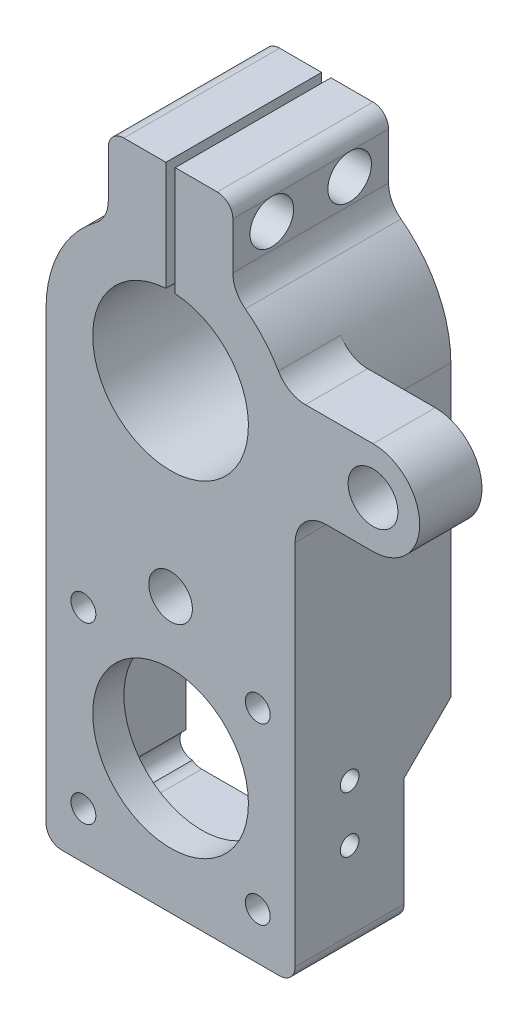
SolidWorks part; units mm, degrees
ref_plane "前视基准面" through (0, 0, 0) normal (0, 0, 1) x (1, 0, 0)
ref_plane "上视基准面" through (0, 0, 0) normal (0, 1, 0) x (1, 0, 0)
ref_plane "右视基准面" through (0, 0, 0) normal (1, 0, 0) x (0, 0, -1)
sketch "草图1" plane through (0, 0, 0) normal (0, 0, 1) x (1, 0, 0)
  line L0 (0, 0) -> (0, 105) construction
  line L1 (0, 0) -> (0, -43) construction
  line L2 (0, -43) -> (40, -43)
  line L3 (0, -43) -> (-40, -43)
  line L4 (0, 105) -> (65, 105) construction
  line L5 (65, 120) -> (43.3013, 120)
  line L6 (65, 90) -> (50, 90)
  line L7 (40, -43) -> (40, 80)
  line L8 (-40, -43) -> (-40, 105)
  line L9 (0, 105) -> (0, 165) construction
  line L10 (0, 165) -> (15, 165)
  line L11 (0, 165) -> (-15, 165)
  line L12 (-20, 160) -> (-20, 145)
  line L13 (20, 160) -> (20, 145)
  line L14 (0, 0) -> (28, 0) construction
  line L15 (28, 0) -> (28, 28) construction
  circle A0 centre (0, 0) radius 25
  circle A1 centre (0, 105) radius 25
  arc A2 (65, 90) -> (65, 120) centre (65, 105) ccw
  circle A3 centre (65, 105) radius 8
  arc A4 (34.641, 125) -> (24, 137) centre (0, 105) ccw
  arc A5 (34.641, 125) -> (43.3013, 120) centre (43.3013, 130) ccw
  arc A6 (50, 90) -> (40, 80) centre (50, 80) ccw
  arc A7 (-24, 137) -> (-40, 105) centre (0, 105) ccw
  arc A8 (20, 145) -> (24, 137) centre (30, 145) ccw
  arc A9 (-20, 145) -> (-24, 137) centre (-30, 145) cw
  arc A10 (15, 165) -> (20, 160) centre (15, 160) cw
  arc A11 (-20, 160) -> (-15, 165) centre (-15, 160) cw
  circle A12 centre (28, 28) radius 4
  circle A13 centre (28, -28) radius 4
  circle A14 centre (-28, -28) radius 4
  circle A15 centre (-28, 28) radius 4
  circle A16 centre (0, 45) radius 7
  dimension "D1" = 10
  dimension "D2" = 10
  dimension "D3" = 5
  dimension "D4" = 45
extrude "凸台-拉伸1" add sketch "草图1" along normal blind 20
fillet "圆角1" radius 5 2 edges at (-40, -43, 10) (40, -43, 10)
sketch "草图4" plane through (0, 0, 0) normal (0, 0, -1) x (-1, 0, 0)
  line L0 (-40, -38) -> (-40, 80) construction
  line L1 (35, -43) -> (-35, -43) construction
  line L2 (40, 105) -> (40, -38) construction
  line L3 (20, 160) -> (20, 145) construction
  line L4 (-15, 165) -> (15, 165) construction
  line L5 (-20, 145) -> (-20, 160) construction
  line L6 (-40, -38) -> (-40, 105)
  line L7 (35, -43) -> (-35, -43)
  line L8 (40, 105) -> (40, -38)
  line L9 (20, 160) -> (20, 145)
  line L10 (-15, 165) -> (15, 165)
  line L11 (-20, 145) -> (-20, 160)
  circle A0 centre (28, -28) radius 4 construction
  circle A1 centre (-28, -28) radius 4 construction
  circle A2 centre (28, 28) radius 4 construction
  circle A3 centre (-28, 28) radius 4 construction
  circle A4 centre (0, 45) radius 7 construction
  circle A5 centre (0, 0) radius 25 construction
  arc A6 (-40, -38) -> (-35, -43) centre (-35, -38) ccw construction
  arc A7 (35, -43) -> (40, -38) centre (35, -38) ccw construction
  arc A8 (20, 145) -> (24, 137) centre (30, 145) ccw construction
  arc A9 (20, 160) -> (15, 165) centre (15, 160) ccw construction
  arc A10 (-15, 165) -> (-20, 160) centre (-15, 160) ccw construction
  arc A11 (-24, 137) -> (-20, 145) centre (-30, 145) ccw construction
  circle A12 centre (0, 105) radius 25 construction
  circle A13 centre (28, -28) radius 4
  circle A14 centre (-28, -28) radius 4
  circle A15 centre (28, 28) radius 4
  circle A16 centre (-28, 28) radius 4
  circle A17 centre (0, 45) radius 7
  circle A18 centre (0, 0) radius 25
  arc A19 (-40, -38) -> (-35, -43) centre (-35, -38) ccw
  arc A20 (35, -43) -> (40, -38) centre (35, -38) ccw
  arc A21 (20, 145) -> (24, 137) centre (30, 145) ccw
  arc A22 (20, 160) -> (15, 165) centre (15, 160) ccw
  arc A23 (-15, 165) -> (-20, 160) centre (-15, 160) ccw
  arc A24 (-24, 137) -> (-20, 145) centre (-30, 145) ccw
  circle A25 centre (0, 105) radius 25
  arc A26 (40, 105) -> (24, 137) centre (0, 105) ccw
  arc A27 (-24, 137) -> (-40, 105) centre (0, 105) ccw
extrude "凸台-拉伸3" add sketch "草图4" along normal blind 30
sketch "草图5" plane through (0, 0, -30) normal (0, 0, -1) x (-1, 0, 0)
  line L0 (0, 0) -> (30, 0) construction
  line L1 (30, 59.1742) -> (30, -28)
  line L2 (25, -33) -> (-25, -33)
  line L3 (-30, -28) -> (-30, 59.1742)
  arc A0 (-16, 68.3394) -> (16, 68.3394) centre (0, 105) ccw
  arc A1 (30, -28) -> (25, -33) centre (25, -28) cw
  arc A2 (-30, -28) -> (-25, -33) centre (-25, -28) ccw
  arc A3 (16, 68.3394) -> (30, 59.1742) centre (20, 59.1742) cw
  arc A4 (-16, 68.3394) -> (-30, 59.1742) centre (-20, 59.1742) ccw
  dimension "D1" = 5
  dimension "D2" = 10
extrude "切除-拉伸1" cut sketch "草图5" against normal blind 40
sketch "草图6" plane through (40, 0, 0) normal (1, 0, 0) x (0, 0, -1)
  line L0 (30, -43) -> (-20, -43) construction
  line L1 (30, -43) -> (15, -43)
  line L2 (30, -43) -> (30, -3) construction
  line L3 (30, -3) -> (15, -3) construction
  line L4 (15, -3) -> (15, -43)
  line L5 (15, -3) -> (30, 12)
  line L6 (30, 105) -> (30, -38) construction
  line L7 (30, 12) -> (30, -43)
extrude "切除-拉伸2" cut sketch "草图6" against normal blind 80
sketch "草图7" plane through (0, 165, 0) normal (0, 1, 0) x (1, 0, 0)
  line L1 (1.5, -40.6413) -> (-1.5, -40.6413)
  line L2 (1.5, -40.6413) -> (1.5, 40.6413)
  line L3 (1.5, 40.6413) -> (-1.5, 40.6413)
  line L4 (-1.5, -40.6413) -> (-1.5, 40.6413)
  line L5 (1.5, -40.6413) -> (-1.5, 40.6413) construction
  line L6 (1.5, 40.6413) -> (-1.5, -40.6413) construction
  point P0 (0, 0)
  dimension "D1" = 3
  dimension "D2" = 81.2825
extrude "切除-拉伸3" cut sketch "草图7" against normal blind 41
sketch "草图8" plane through (20, 0, 0) normal (1, 0, 0) x (0, 0, -1)
  line L0 (-20, 145) -> (-20, 160) construction
  line L1 (30, 160) -> (30, 145) construction
  line L2 (-20, 165) -> (30, 165) construction
  line L3 (30, 165) -> (-20, 165) construction
  circle A0 centre (-7.5, 153) radius 7
  circle A1 centre (17.5, 153) radius 7
  point P6 (-20, 152.5)
  dimension "D1" = 12.5
  dimension "D2" = 12.5
  dimension "D3" = 12
  dimension "D4" = 12
extrude "切除-拉伸4" cut sketch "草图8" against normal blind 10
sketch "草图9" plane through (10, 0, 0) normal (1, 0, 0) x (0, 0, -1)
  circle A0 centre (-7.5, 153) radius 4.5
  circle A1 centre (17.5, 153) radius 4.5
extrude "切除-拉伸5" cut sketch "草图9" against normal through all
sketch "草图10" plane through (40, 0, 0) normal (1, 0, 0) x (0, 0, -1)
  line L0 (-20, -38) -> (-20, 80) construction
  line L1 (15, -43) -> (-20, -43) construction
  circle A0 centre (-2.5, -13) radius 3
  circle A1 centre (-2.5, 5) radius 3
  circle A2 centre (-2.5, 77) radius 3
  dimension "D1" = 17.5
  dimension "D2" = 17.5
  dimension "D3" = 17.5
  dimension "D4" = 30
  dimension "D5" = 18
  dimension "D6" = 72
extrude "切除-拉伸6" cut sketch "草图10" against normal blind 10
sketch "草图12" plane through (-40, 0, 0) normal (-1, 0, 0) x (0, 0, 1)
  line L0 (20, 105) -> (20, 137) construction
  line L1 (20, 105) -> (20, -38) construction
  line L3 (20, 105) -> (-30, 105) construction
  circle A0 centre (0, 115) radius 2.5
  circle A1 centre (0, 127) radius 2.5
  dimension "D1" = 20
  dimension "D2" = 20
  dimension "D3" = 10
  dimension "D4" = 12
extrude "切除-拉伸8" cut sketch "草图12" against normal blind 15
